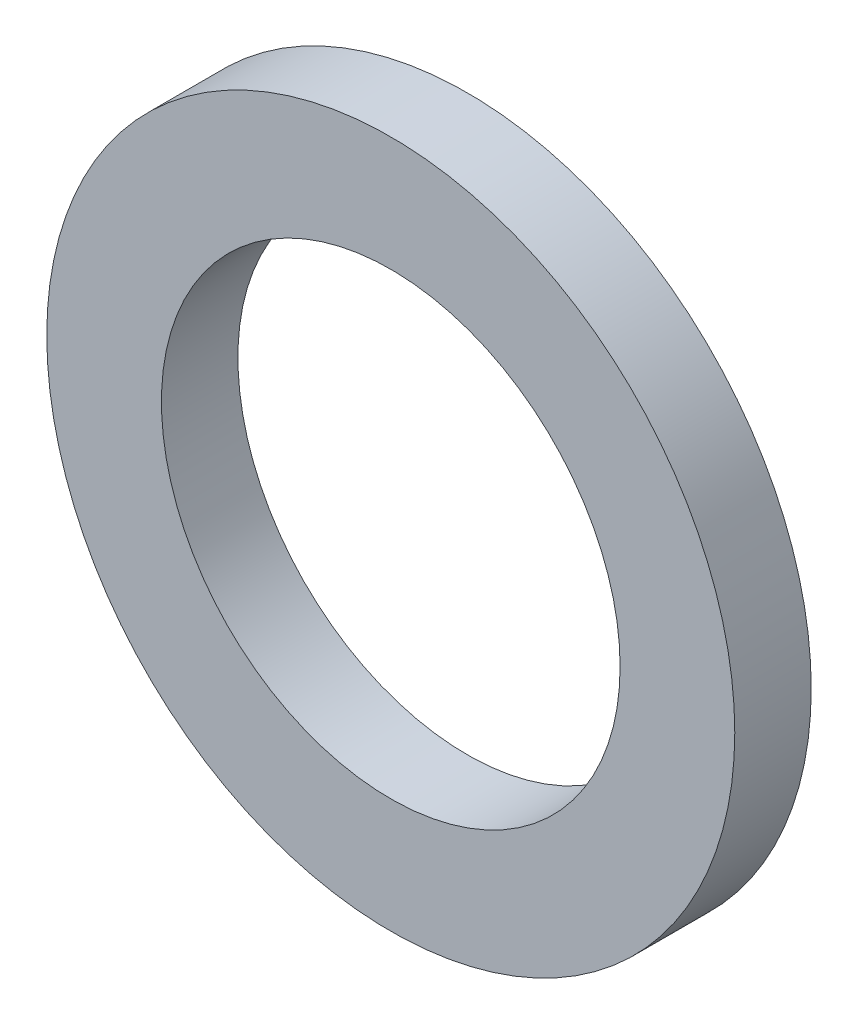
SolidWorks part; units mm, degrees
ref_plane "前视基准面" through (0, 0, 0) normal (0, 0, 1) x (1, 0, 0)
ref_plane "上视基准面" through (0, 0, 0) normal (0, 1, 0) x (1, 0, 0)
ref_plane "右视基准面" through (0, 0, 0) normal (1, 0, 0) x (0, 0, -1)
sketch "草图1" plane through (0, 0, 0) normal (0, 0, 1) x (1, 0, 0)
  circle A0 centre (0, 0) radius 30
  circle A1 centre (0, 0) radius 45
  dimension "D1" = 60
  dimension "D2" = 90
extrude "拉伸1" add sketch "草图1" along normal blind 10
